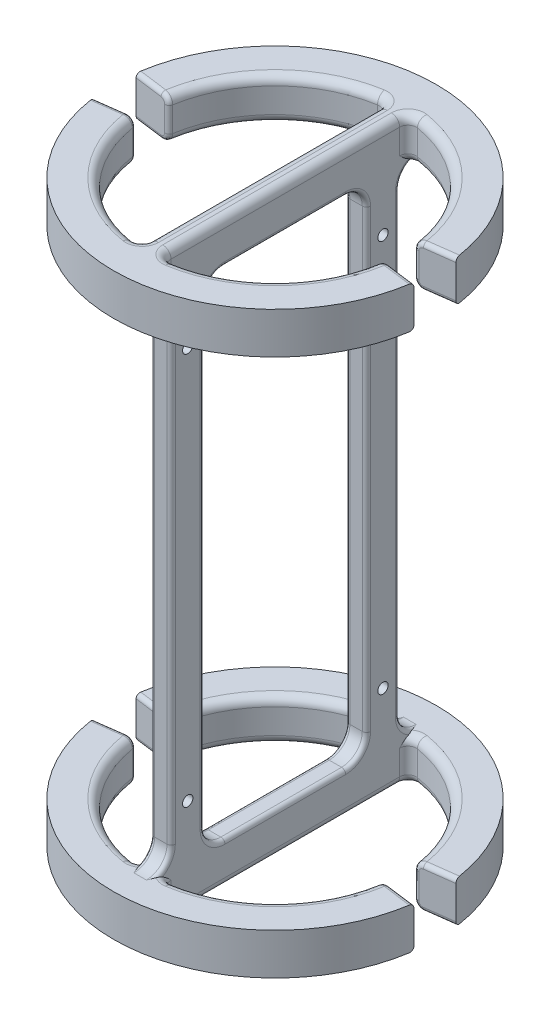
SolidWorks part; units mm, degrees
ref_plane "Front Plane" through (0, 0, 0) normal (0, 0, 1) x (1, 0, 0)
ref_plane "Top Plane" through (0, 0, 0) normal (0, 1, 0) x (1, 0, 0)
ref_plane "Right Plane" through (0, 0, 0) normal (1, 0, 0) x (0, 0, -1)
sketch "Sketch1" plane through (0, 0, 0) normal (0, 1, 0) x (1, 0, 0)
  line L0 (-3.175, -37.9675) -> (-3.175, 37.9675)
  line L3 (3.175, -37.9675) -> (3.175, 37.9675)
  line L4 (-3.164, -37.9684) -> (3.175, 38.1) construction
  line L5 (-3.164, 37.9684) -> (3.164, -37.9684) construction
  circle A0 centre (0, 0) radius 49.53
  circle A1 centre (0, 0) radius 38.1
  dimension "D1" = 99.06
  dimension "D2" = 76.2
  dimension "D3" = 6.35
extrude "Boss-Extrude1" add sketch "Sketch1" along normal blind 12.7 contours A0 A1 | L3 A1 L0
sketch "Sketch4" plane through (0, 12.7, 0) normal (0, 1, 0) x (1, 0, 0)
  line L4 (-3.175, -35.052) -> (-3.175, 35.052)
  line L5 (-3.175, -35.052) -> (3.175, -35.052)
  line L6 (-3.175, 35.052) -> (3.175, 35.052)
  line L7 (3.175, -35.052) -> (3.175, 35.052)
  line L8 (-3.175, -35.052) -> (3.175, 35.052) construction
  line L9 (-3.175, 35.052) -> (3.175, -35.052) construction
  line L11 (3.175, -24.892) -> (-3.175, -24.892)
  line L12 (3.175, -24.892) -> (3.175, 24.892)
  line L13 (3.175, 24.892) -> (-3.175, 24.892)
  line L14 (-3.175, -24.892) -> (-3.175, 24.892)
  point P1 (0, 0)
  dimension "D1" = 70.104
  dimension "D2" = 6.35
  dimension "D3" = 10.16
  dimension "D4" = 10.16
extrude "Boss-Extrude4" add sketch "Sketch4" along normal blind 152.4 contours L11 L4 L5 M8 | L13 L6 M8 M10
sketch "Sketch6" plane through (0, 165.1, 0) normal (0, 1, 0) x (1, 0, 0)
  line L0 (-3.175, 0) -> (-3.175, 37.9675)
  line L1 (-3.175, -24.892) -> (-3.175, 24.892) construction
  line L2 (-3.175, 0) -> (-3.175, -37.9675)
  line L3 (3.175, 0) -> (3.175, -37.9675)
  line L4 (3.175, -24.892) -> (3.175, 24.892) construction
  line L5 (3.175, 0) -> (3.175, 37.9675)
  circle A0 centre (0, 0) radius 49.53
  circle A1 centre (0, 0) radius 38.1
extrude "Boss-Extrude7" add sketch "Sketch6" along normal blind 12.7 contours A0 A1 | L2 A1 L3 M6 | M6 M3 M4 M5 | L5 A1 L0 L2 L3 M4
fillet "Fillet1" radius 6.35 8 edges at (0, 12.7, 24.892) (0, 12.7, 35.052) (0, 165.1, 24.892) (0, 165.1, 35.052) (0, 165.1, -24.892) (0, 165.1, -35.052) (0, 12.7, -24.892) (0, 12.7, -35.052)
fillet "Fillet5" radius 2.54 8 edges at (3.175, 171.45, -37.9675) (3.175, 171.45, 37.9675) (-3.175, 6.35, -37.9675) (-3.175, 6.35, 37.9675) (3.175, 6.35, -37.9675) (3.175, 6.35, 37.9675) (-3.175, 171.45, 37.9675) (-3.175, 171.45, -37.9675)
fillet "Fillet6" radius 2.54 28 edges at (-3.175, 177.8, 0) (-3.175, 0, 0) (-38.1, 0, 0) (-38.1, 12.7, 0) (38.1, 0, 0) (38.1, 12.7, 0) (3.175, 0, 0) (3.175, 177.8, 0) (-38.1, 165.1, 0) (-38.1, 177.8, 0) (38.1, 165.1, 0) (38.1, 177.8, 0) (-4.0696, 0, -37.0328) (-4.0696, 12.7, -37.0328) (4.0696, 0, -37.0328) (4.0696, 12.7, -37.0328) (4.0696, 0, 37.0328) (4.0696, 12.7, 37.0328) (-4.0696, 0, 37.0328) (-4.0696, 12.7, 37.0328) (-4.0696, 165.1, 37.0328) (-4.0696, 177.8, 37.0328) (4.0696, 165.1, 37.0328) (4.0696, 177.8, 37.0328) (-4.0696, 165.1, -37.0328) (-4.0696, 177.8, -37.0328) (4.0696, 165.1, -37.0328) (4.0696, 177.8, -37.0328)
fillet "Fillet7" radius 1.27 28 edges at (-3.175, 14.5599, 36.9119) (3.175, 14.5599, 36.9119) (-3.175, 88.9, 35.052) (3.175, 88.9, 35.052) (3.175, 163.2401, 36.9119) (-3.175, 163.2401, 36.9119) (-3.175, 163.2401, -36.9119) (3.175, 163.2401, 23.0321) (3.175, 165.1, 0) (3.175, 163.2401, -23.0321) (3.175, 163.2401, -36.9119) (-3.175, 163.2401, -23.0321) (-3.175, 165.1, 0) (-3.175, 163.2401, 23.0321) (3.175, 88.9, 24.892) (-3.175, 88.9, 24.892) (3.175, 14.5599, 23.0321) (-3.175, 14.5599, 23.0321) (-3.175, 88.9, -24.892) (3.175, 88.9, -24.892) (3.175, 14.5599, -23.0321) (3.175, 12.7, 0) (-3.175, 14.5599, -23.0321) (-3.175, 12.7, 0) (3.175, 88.9, -35.052) (-3.175, 88.9, -35.052) (3.175, 14.5599, -36.9119) (-3.175, 14.5599, -36.9119)
sketch "Sketch7" plane through (0, 0, 0) normal (0, -1, 0) x (1, 0, 0)
  line L0 (-37.774, -4.973) -> (-49.1063, -6.465)
  line L1 (54.483, 0) -> (-54.483, 0) construction
  line L2 (-37.774, 4.973) -> (-49.1063, 6.465)
  line L3 (0, -54.483) -> (0, 54.483) construction
  line L4 (37.774, 4.973) -> (49.1063, 6.465)
  line L5 (37.774, -4.973) -> (49.1063, -6.465)
  arc A0 (-49.1063, 6.465) -> (-49.1063, -6.465) centre (0, 0) ccw
  arc A2 (-37.774, 4.973) -> (-37.774, -4.973) centre (0, 0) ccw
  arc A4 (37.774, 4.973) -> (37.774, -4.973) centre (0, 0) cw
  arc A5 (49.1063, 6.465) -> (49.1063, -6.465) centre (0, 0) cw
extrude "Cut-Extrude1" cut sketch "Sketch7" against normal through all and the other way through all contours L2 L0 M1 M9 | L5 L4 M8 M9 | L4 A4 L5 M8 | A2 L2 L0 M1
fillet "Fillet8" radius 1.27 46 edges at (38.5116, 0.7439, -5.0702) (38.5116, 0.7439, 5.0702) (-38.5116, 0.7439, 5.0702) (-38.5116, 0.7439, -5.0702) (38.5116, 177.0561, 5.0702) (37.774, 171.45, 4.973) (38.5116, 165.8439, 5.0702) (44.6993, 165.1, 5.8848) (44.6993, 12.7, 5.8848) (38.5116, 11.9561, 5.0702) (37.774, 6.35, 4.973) (44.6993, 165.1, -5.8848) (44.6993, 177.8, -5.8848) (44.6993, 12.7, -5.8848) (38.5116, 11.9561, -5.0702) (38.5116, 165.8439, -5.0702) (38.5116, 177.0561, -5.0702) (37.774, 171.45, -4.973) (37.774, 6.35, -4.973) (44.6993, 177.8, 5.8848) (-38.5116, 177.0561, -5.0702) (-37.774, 171.45, -4.973) (-38.5116, 165.8439, -5.0702) (-44.6993, 165.1, -5.8848) (-44.6993, 12.7, -5.8848) (-38.5116, 11.9561, -5.0702) (-37.774, 6.35, -4.973) (-44.6993, 165.1, 5.8848) (-44.6993, 177.8, 5.8848) (-44.6993, 12.7, 5.8848) (-38.5116, 11.9561, 5.0702) (-38.5116, 165.8439, 5.0702) (-38.5116, 177.0561, 5.0702) (-37.774, 171.45, 4.973) (-37.774, 6.35, 4.973) (-44.6993, 177.8, -5.8848)
sketch "Sketch12" plane through (3.175, 0, 0) normal (1, 0, 0) x (0, 0, -1)
  line L0 (33.782, 158.75) -> (26.162, 158.75) construction
  line L1 (33.782, 19.05) -> (26.162, 19.05) construction
  line L2 (29.972, 158.75) -> (29.972, 19.05) construction
  arc A0 (26.162, 158.75) -> (18.542, 166.37) centre (18.542, 158.75) ccw construction
hole_wizard "1/8 (0.125) Diameter Hole1" positions "Sketch13" profile "Sketch14" hole size "1/8" standard "ANSI Inch"
sketch "Sketch13" plane through (3.175, 0, 0) normal (1, 0, 0) x (0, 0, -1)
  line L0 (29.972, 158.75) -> (29.972, 19.05) construction
  line L1 (33.782, 158.75) -> (26.162, 158.75) construction
  line L2 (33.782, 19.05) -> (26.162, 19.05) construction
  point P0 (29.972, 149.1488)
  point P4 (29.972, 28.6512)
  dimension "D1" = 9.6012
  dimension "D2" = 9.6012
sketch "Sketch14" plane through (3.175, 149.1488, -29.972) normal (0, 1, 0) x (0, 0, -1)
  line L0 (0, 0) -> (0, 52.3529)
  line L1 (0, 52.3529) -> (1.5875, 52.3529)
  line L2 (1.5875, 52.3529) -> (1.5875, 0)
  line L5 (1.5875, 0) -> (0, 0)
  line L11 (0, -6.35) -> (0, 107.95) construction
  dimension "Thru Hole Dia." = 3.175
  dimension "Thru Hole Depth" = 52.3529
mirror "Mirror2" about plane through (0, 0, 0) normal (0, 0, 1) of "1/8 (0.125) Diameter Hole1"
